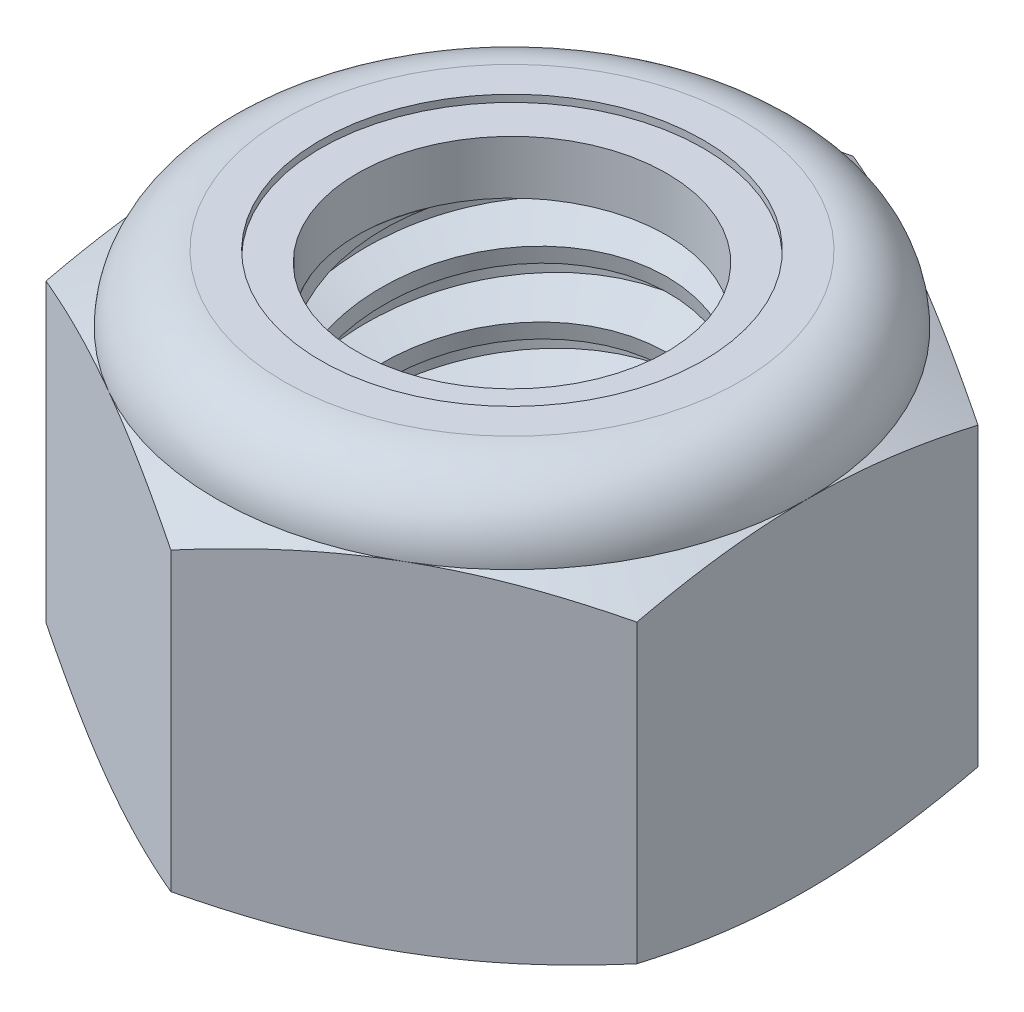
SolidWorks part; units mm, degrees
ref_plane "Front" through (0, 0, 0) normal (0, 0, 1) x (1, 0, 0)
ref_plane "Top" through (0, 0, 0) normal (0, 1, 0) x (1, 0, 0)
ref_plane "Right" through (0, 0, 0) normal (1, 0, 0) x (0, 0, -1)
sketch "Sketch1" plane through (0, 0, 0) normal (0, 1, 0) x (1, 0, 0)
  line L1 (0, 7.3323) -> (-6.35, 3.6662)
  line L2 (-6.35, 3.6662) -> (-6.35, -3.6662)
  line L3 (-6.35, -3.6662) -> (0, -7.3323)
  line L4 (0, -7.3323) -> (6.35, -3.6662)
  line L5 (6.35, -3.6662) -> (6.35, 3.6662)
  line L6 (6.35, 3.6662) -> (0, 7.3323)
  circle A0 centre (0, 0) radius 6.35 construction
  dimension "Hex Flats" = 12.7
extrude "Extrude1" add sketch "Sketch1" along normal blind 8.7312
sketch "Sketch2" plane through (0, 0, 0) normal (1, 0, 0) x (0, 0, -1)
  line L0 (-3.9688, 0) -> (-3.9688, 8.7312) construction
  line L1 (0, 0) -> (3.9688, 0)
  line L2 (0, 0) -> (0, 8.7312)
  line L3 (0, 8.7312) -> (3.9688, 8.7312)
  line L4 (3.9688, 0) -> (3.9688, 8.7312)
  line L5 (-3.6662, 8.7312) -> (3.6662, 8.7312) construction
  line L7 (0, -3.9688) -> (0, 0) construction
  dimension "Thread Dia" = 7.9375
revolve "Revolve1" add sketch "Sketch2" angle 360 about L7
sketch "Sketch3" plane through (0, 0, 0) normal (1, 0, 0) x (0, 0, -1)
  line L0 (3.9688, 8.7312) -> (-3.9687, 8.7312) construction
  line L1 (-3.9687, 8.7312) -> (-3.9688, 7.3201) construction
  line L2 (-3.9688, 7.3201) -> (3.9688, 8.7312) construction
  line L3 (3.9688, 8.7312) -> (3.9996, 8.5576) construction
  line L4 (3.9996, 8.5576) -> (4.2157, 7.3419)
  line L5 (4.2157, 7.3419) -> (3.3866, 7.6424)
  line L6 (3.3866, 7.6424) -> (3.3248, 7.9897)
  line L7 (3.3248, 7.9897) -> (3.9996, 8.5576)
  line L8 (3.3557, 7.8161) -> (4.1077, 7.9498) construction
  line L9 (3.9688, 8.7312) -> (3.9688, 7.9251) construction
  line L10 (3.9688, 7.9251) -> (-3.9688, 6.5139) construction
  line L11 (-3.9688, 6.5139) -> (-3.9688, 7.3201) construction
  line L12 (-0.2688, 8.7312) -> (0.2688, 5.7077) construction
  line L13 (-3.9688, 0) -> (-3.9688, 8.7312) construction
  line L14 (0, 8.7312) -> (3.9688, 8.7312) construction
  line L15 (3.9688, 0) -> (3.9688, 8.7312) construction
  point P13 (0, 7.2195)
revolve "Cut-Revolve1" cut sketch "Sketch3" angle 360 about L12
pattern_linear "LPattern1" count 6 spacing 1.4111 along (0, -1, 0) count 2 spacing 1.4111 along (0, 1, 0) of "Cut-Revolve1"
sketch "Sketch4" plane through (0, 0, 0) normal (1, 0, 0) x (0, 0, -1)
  line L0 (0, 8.7312) -> (3.9688, 8.7312)
  line L1 (3.9688, 8.7312) -> (3.3248, 8.431)
  line L2 (3.3248, 8.431) -> (3.3248, 0.3003)
  line L3 (3.3248, 0.3003) -> (3.9688, 0)
  line L4 (3.9688, 0) -> (0, 0)
  line L5 (0, 0) -> (0, 8.7312)
  line L6 (3.9688, 0) -> (3.9688, 8.7312) construction
  line L7 (0, 8.7312) -> (3.9688, 8.7312) construction
  line L8 (0, 0) -> (3.9688, 0) construction
  line L9 (0, 0) -> (0, 8.7312) construction
  line L10 (0, 8.7312) -> (0, 9.4418) construction
  dimension "D1" = 25
revolve "Cut-Revolve2" cut sketch "Sketch4" angle 360 about L10
combine bodies "Combine1" operation type subtract main body 112 bodies to subtract 111
sketch "Sketch5" plane through (0, 0, 0) normal (1, 0, 0) x (0, 0, -1)
  line L0 (0, 0) -> (6.35, 0)
  line L1 (6.35, 0) -> (7.3323, 0.4581)
  line L2 (7.3323, 0.4581) -> (7.3323, 6.818)
  line L3 (7.3323, 6.818) -> (6.35, 7.276)
  line L4 (4.8948, 8.7312) -> (4.8948, 10.0012)
  line L5 (4.8948, 10.0012) -> (8.6023, 10.0012)
  line L6 (8.6023, 10.0012) -> (8.6023, -1.27)
  line L7 (8.6023, -1.27) -> (0, -1.27)
  line L8 (0, -1.27) -> (0, 0)
  line L9 (6.35, 7.276) -> (6.35, 0) construction
  line L10 (0, 0) -> (3.9688, 0) construction
  line L13 (7.3323, 3.638) -> (8.6023, 3.638) construction
  line L14 (7.3323, 8.7312) -> (7.3323, 0) construction
  line L15 (0, 0) -> (0, 10.0012) construction
  line L20 (0, 10.0012) -> (4.8948, 10.0012) construction
  line L22 (0, 8.7312) -> (3.9688, 8.7312) construction
  arc A0 (6.35, 7.276) -> (4.8948, 8.7312) centre (4.8948, 7.276) ccw
revolve "Cut-Revolve3" cut sketch "Sketch5" angle 360 about L15
sketch "Sketch6" plane through (0, 0, 0) normal (1, 0, 0) x (0, 0, -1)
  line L0 (0, 7.276) -> (6.1976, 7.276)
  line L1 (4.8948, 8.5788) -> (4.1098, 8.5788)
  line L2 (0, 10.0012) -> (0, 7.276)
  line L3 (4.1098, 10.0012) -> (0, 10.0012)
  line L4 (0, 10.0012) -> (4.8948, 10.0012) construction
  line L5 (0, 0) -> (0, 10.0012) construction
  line L6 (0, 10.0012) -> (0, 44.323) construction
  line L7 (4.1098, 8.5788) -> (4.1098, 10.0012)
  line L8 (4.8948, 8.7312) -> (4.8948, 8.5788) construction
  line L9 (4.1098, 8.5788) -> (3.3248, 8.5788) construction
  line L10 (3.3248, 8.5788) -> (3.3248, 8.431) construction
  arc A0 (6.1976, 7.276) -> (4.8948, 8.5788) centre (4.8948, 7.276) ccw
  arc A1 (6.35, 7.276) -> (4.8948, 8.7312) centre (4.8948, 7.276) ccw construction
  dimension "D1" = 0.1524
revolve "Cut-Revolve4" cut sketch "Sketch6" angle 360 about L6
sketch "Sketch7" plane through (0, 0, 0) normal (1, 0, 0) x (0, 0, -1)
  line L0 (3.3248, 7.3522) -> (6.119, 7.3522)
  line L1 (4.8948, 8.5027) -> (3.3248, 8.5027)
  line L2 (3.3248, 8.5027) -> (3.3248, 7.3522)
  line L3 (3.3248, 7.3522) -> (0, 7.3522) construction
  line L4 (0, 7.3522) -> (0, 8.5027) construction
  line L5 (0, 8.5027) -> (3.3248, 8.5027) construction
  line L6 (3.3248, 7.3522) -> (3.3248, 7.276) construction
  line L7 (0, 7.276) -> (6.1976, 7.276) construction
  line L8 (4.8948, 8.5027) -> (4.8948, 8.5788) construction
  arc A0 (6.119, 7.3522) -> (4.8948, 8.5027) centre (4.8948, 7.276) ccw
  arc A2 (6.1976, 7.276) -> (4.8948, 8.5788) centre (4.8948, 7.276) ccw construction
  dimension "D1" = 0.0762
revolve "Revolve2" add sketch "Sketch7" angle 360 about L4
equation "\"D1@Sketch3\"=\"Thread Pitch@Sketch3\"/8"
equation "\"D2@Sketch3\"=\"Thread Pitch@Sketch3\"/4"
equation "\"D5@Sketch3\"=\"Thread Pitch@Sketch3\""
equation "\"D4@LPattern1\"=\"Thread Pitch@Sketch3\""
equation "\"D3@LPattern1\"=\"Thread Pitch@Sketch3\""
equation "\"D1@LPattern1\"=\"Height@Extrude1\"/\"Thread Pitch@Sketch3\""
equation "\"D4@Sketch5\"=\"Height@Extrude1\"/6"
